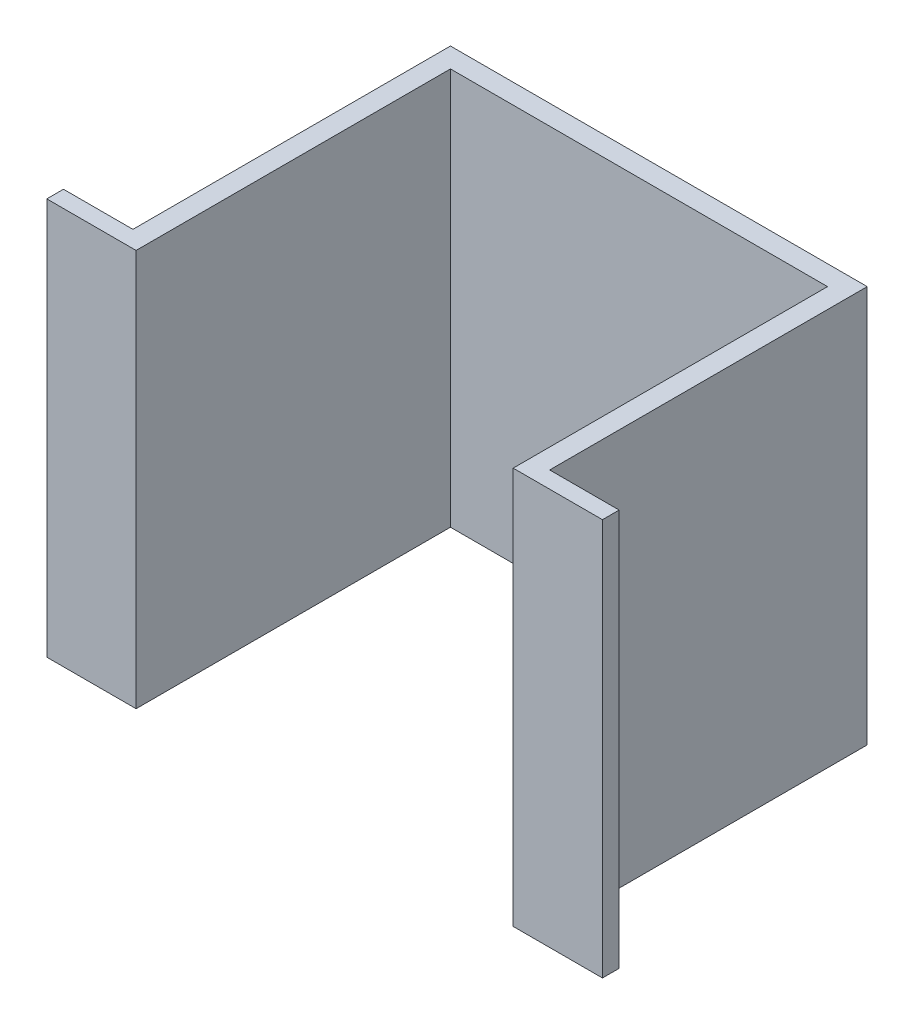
SolidWorks part; units mm, degrees
ref_plane "Front Plane" through (0, 0, 0) normal (0, 0, 1) x (1, 0, 0)
ref_plane "Top Plane" through (0, 0, 0) normal (0, 1, 0) x (1, 0, 0)
ref_plane "Right Plane" through (0, 0, 0) normal (1, 0, 0) x (0, 0, -1)
sketch "Sketch1" plane through (0, 0, 0) normal (0, 0, 1) x (1, 0, 0)
  line L1 (-21, 20) -> (21, 20)
  line L2 (-21, 20) -> (-21, -20)
  line L3 (-21, -20) -> (21, -20)
  line L4 (21, 20) -> (21, -20)
  line L5 (-21, 20) -> (21, -20) construction
  line L6 (-21, -20) -> (21, 20) construction
  point P0 (0, 0)
  dimension "D1" = 40
  dimension "D2" = 42
extrude "Boss-Extrude1" add sketch "Sketch1" along normal blind 2
sketch "Sketch2" plane through (0, 20, 0) normal (0, 1, 0) x (1, 0, 0)
  line L0 (-21, -2) -> (-21, -32)
  line L2 (-19, -32) -> (-19, -2)
  line L3 (21, -2) -> (-21, -2) construction
  line L5 (19, -2) -> (19, -32)
  line L7 (21, -32) -> (21, -2)
  line L9 (-21, -2) -> (-19, -2)
  line L10 (21, -2) -> (19, -2)
  line L11 (-21, -32) -> (-28, -32)
  line L12 (-28, -32) -> (-28, -33.6814)
  line L13 (-28, -33.6814) -> (-19, -33.6814)
  line L14 (-19, -33.6814) -> (-19, -32)
  line L15 (21, -32) -> (28, -32)
  line L16 (28, -32) -> (28, -33.6814)
  line L17 (28, -33.6814) -> (19, -33.6814)
  line L18 (19, -33.6814) -> (19, -32)
  dimension "D1" = 30
  dimension "D2" = 30
  dimension "D3" = 2
  dimension "D4" = 2
  dimension "D5" = 9
  dimension "D6" = 9
extrude "Boss-Extrude2" add sketch "Sketch2" against normal through all
